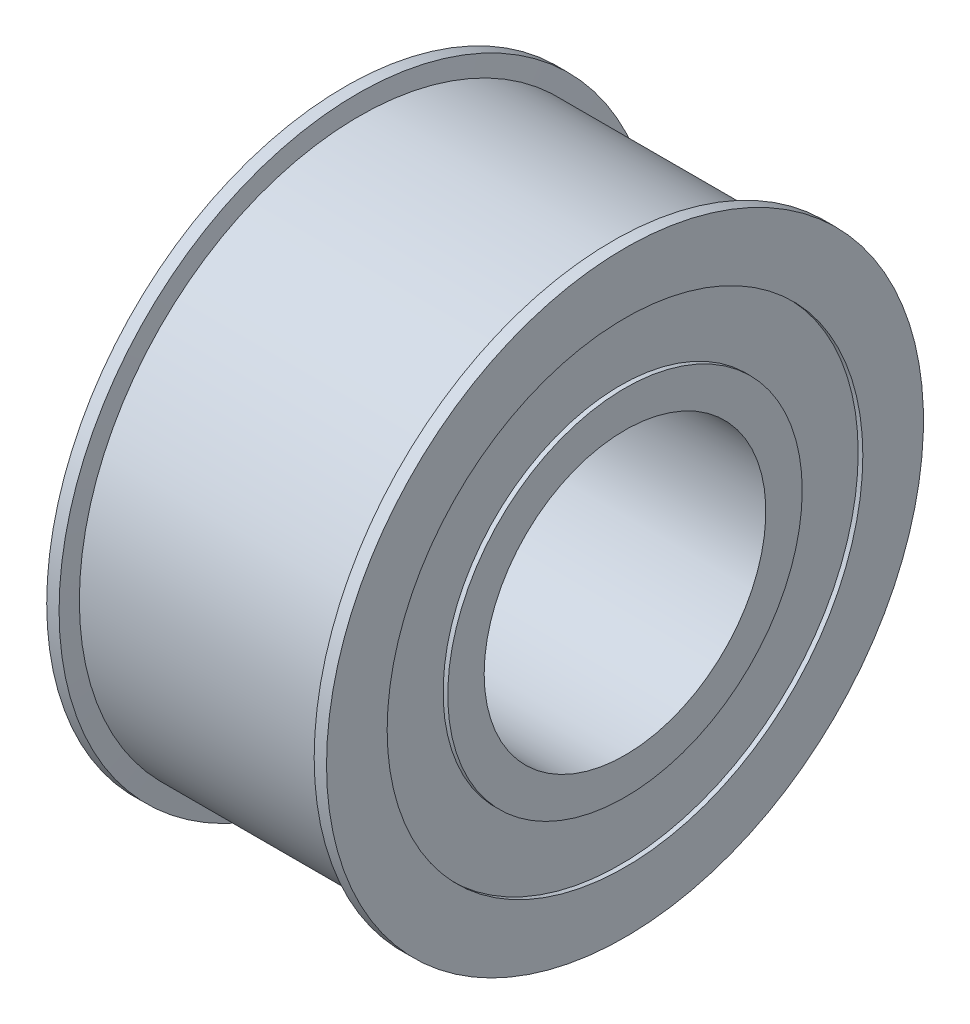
SolidWorks part; units mm, degrees
ref_plane "Front Plane" through (0, 0, 0) normal (0, 0, 1) x (1, 0, 0)
ref_plane "Top Plane" through (0, 0, 0) normal (0, 1, 0) x (1, 0, 0)
ref_plane "Right Plane" through (0, 0, 0) normal (1, 0, 0) x (0, 0, -1)
sketch "Sketch2" plane through (0, 0, 0) normal (0, 0, 1) x (1, 0, 0)
  line L0 (0, 0) -> (15, 0) construction
  line L1 (15, 0) -> (15, 15.1) construction
  line L2 (15, 15.1) -> (15, 32)
  line L3 (15, 32) -> (13.675, 32)
  line L4 (13.675, 32) -> (13.5, 30)
  line L5 (13.5, 30) -> (-13.5, 30)
  line L6 (0, 30) -> (0, 0) construction
  line L7 (-15, 15.1) -> (15, 15.1)
  line L9 (-13.675, 32) -> (-13.5, 30)
  line L10 (-15, 32) -> (-13.675, 32)
  line L11 (-15, 15.1) -> (-15, 32)
  point P13 (0, 15.1)
  dimension "D1" = 5
  dimension "D2" = 2
  dimension "D3" = 30.2
  dimension "D4" = 60
  dimension "D5" = 27
  dimension "D6" = 1.5
revolve "Revolve1" add sketch "Sketch2" angle 360 about L0
sketch "Sketch3" plane through (15, 0, 0) normal (1, 0, 0) x (0, 0, -1)
  circle A0 centre (0, 0) radius 19
  circle A1 centre (0, 0) radius 25.5
  dimension "D1" = 38
  dimension "D2" = 51
extrude "Cut-Extrude1" cut sketch "Sketch3" against normal blind 0.5
sketch "Sketch4" plane through (-15, 0, 0) normal (-1, 0, 0) x (0, 0, 1)
  circle A1 centre (0, 0) radius 25.5
  circle A2 centre (0, 0) radius 25.5
  circle A3 centre (0, 0) radius 19
  circle A4 centre (0, 0) radius 19
  dimension "D1" = 0
  dimension "D2" = 0
extrude "Cut-Extrude2" cut sketch "Sketch4" against normal blind 0.5
sketch "Sketch5" plane through (0, 0, 0) normal (0, 1, 0) x (1, 0, 0)
  line L0 (0, 0) -> (0, 39.0551) construction
  line L1 (-13.5, 30) -> (13.5, 30)
  line L2 (-13.2207, 48.1102) -> (13.2207, 48.1102)
  line L3 (-13.2207, 48.1102) -> (-13.2207, 30)
  line L4 (-13.2207, 30) -> (13.2207, 30)
  line L5 (13.2207, 48.1102) -> (13.2207, 30)
  line L6 (-13.2207, 48.1102) -> (13.2207, 30) construction
  line L7 (-13.2207, 30) -> (13.2207, 48.1102) construction
  line L8 (13.5, -30) -> (-13.5, -30)
  line L9 (0, 0) -> (26.3192, 0) construction
  line L10 (-13.5, 30) -> (13.5, 30) construction
  line L11 (-13.5, -30) -> (13.5, -30) construction
  line L12 (-13.2207, -30) -> (13.2207, -48.1102) construction
  line L13 (-13.2207, -48.1102) -> (13.2207, -30) construction
  line L14 (13.2207, -48.1102) -> (13.2207, -30)
  line L15 (-13.2207, -30) -> (13.2207, -30)
  line L16 (-13.2207, -48.1102) -> (-13.2207, -30)
  line L17 (-13.2207, -48.1102) -> (13.2207, -48.1102)
  dimension "D1" = 18.1102
  dimension "D2" = 26.4414
